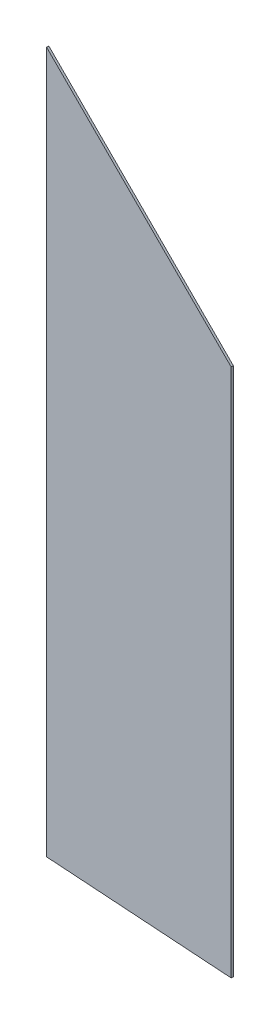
SolidWorks part; units mm, degrees
ref_plane "Front Plane" through (0, 0, 0) normal (0, 0, 1) x (1, 0, 0)
ref_plane "Top Plane" through (0, 0, 0) normal (0, 1, 0) x (1, 0, 0)
ref_plane "Right Plane" through (0, 0, 0) normal (1, 0, 0) x (0, 0, -1)
sketch "Sketch1" plane through (0, 0, 0) normal (0, 0, 1) x (1, 0, 0)
  line L0 (0, 0) -> (0, 1533.525)
  line L1 (0, 1533.525) -> (-534.9875, 2068.5125)
  line L2 (-534.9875, 2068.5125) -> (-534.9875, 0)
  line L3 (-534.9875, 0) -> (0, 0)
  dimension "D1" = 2068.5125
  dimension "D2" = 534.9875
  dimension "D3" = 45
sheet metal parameters "Sheet-Metal1" thickness 6.35 parameters "D1"=6.35
base flange "Base-Flange1" sketch "Sketch1" thickness 6.35 reverse thickness direction no parameters "D1"=6.35
sketch "Sketch3" plane through (0, 0, 0) normal (0, 0, 1) x (1, 0, 0)
  line L0 (0, 0) -> (-534.9875, 36.5125)
  line L1 (-534.9875, 2068.5125) -> (-534.9875, 0) construction
  line L2 (-534.9875, 36.5125) -> (-534.9875, 0)
  line L3 (-534.9875, 0) -> (0, 0)
  dimension "D1" = 36.5125
extrude "Cut-Extrude1" cut sketch "Sketch3" against normal through all
flat pattern "Flat-Pattern1"
sketch "Bend-Lines1" plane through (0, 0, 0) normal (0, 1, 0) x (-1, 0, 0)
sketch3d "Bounding-Box1" [suppressed]
  line L0 (0, 2068.5125, 0) -> (0, 0, 0) construction
  line L1 (-534.9875, 2068.5125, 0) -> (-534.9875, 0, 0) construction
  line L2 (0, 2068.5125, 0) -> (-534.9875, 2068.5125, 0) construction
  line L3 (0, 0, 0) -> (-534.9875, 0, 0) construction
